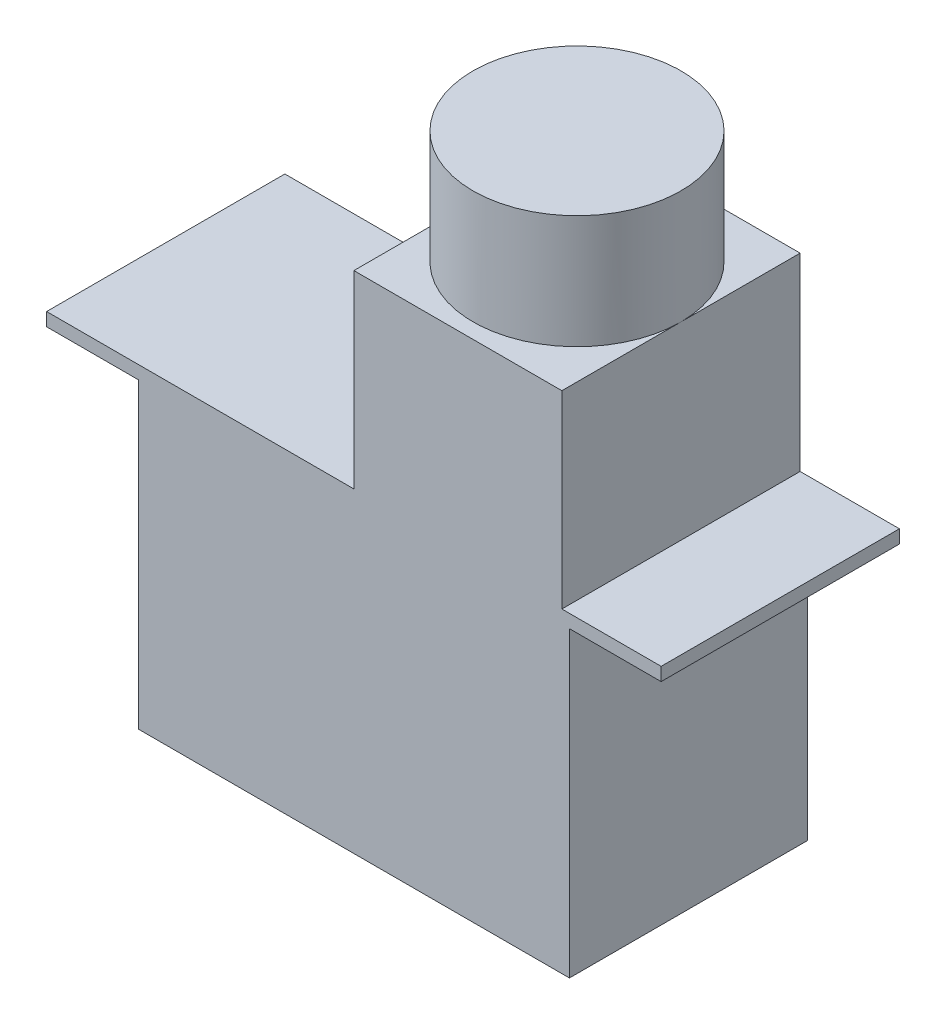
SolidWorks part; units mm, degrees
ref_plane "Front Plane" through (0, 0, 0) normal (0, 0, 1) x (1, 0, 0)
ref_plane "Top Plane" through (0, 0, 0) normal (0, 1, 0) x (1, 0, 0)
ref_plane "Right Plane" through (0, 0, 0) normal (1, 0, 0) x (0, 0, -1)
sketch "Sketch1" plane through (0, 0, 0) normal (0, 1, 0) x (1, 0, 0)
  line L1 (0, 0) -> (22.8, 0)
  line L2 (0, 0) -> (0, 12.6)
  line L3 (0, 12.6) -> (22.8, 12.6)
  line L4 (22.8, 0) -> (22.8, 12.6)
  dimension "D1" = 22.8
  dimension "D2" = 12.6
extrude "Boss-Extrude1" add sketch "Sketch1" along normal blind 16
sketch "Sketch2" plane through (0, 16, 0) normal (0, 1, 0) x (1, 0, 0)
  line L0 (11.4, 12.6) -> (11.4, 0) construction
  line L1 (27.65, 6.3) -> (-4.85, 6.3) construction
  line L2 (22.8, 12.6) -> (0, 12.6) construction
  line L3 (-4.85, 6.3) -> (-4.85, 12.6)
  line L4 (0, 0) -> (22.8, 0) construction
  line L5 (-4.85, 12.6) -> (27.65, 12.6)
  line L6 (27.65, 12.6) -> (27.65, 0)
  line L7 (27.65, 0) -> (-4.85, 0)
  line L8 (-4.85, 0) -> (-4.85, 6.3)
  point P9 (11.4, 6.3)
  dimension "D1" = 32.5
  dimension "D2" = 90
extrude "Boss-Extrude2" add sketch "Sketch2" along normal blind 0.7
sketch "Sketch3" plane through (0, 16.7, 0) normal (0, 1, 0) x (1, 0, 0)
  line L0 (11.4, 0) -> (11.4, 12.6)
  line L1 (-4.85, 0) -> (27.65, 0) construction
  line L2 (27.65, 12.6) -> (-4.85, 12.6) construction
  line L3 (11.4, 12.6) -> (22.4, 12.6)
  line L6 (22.4, 12.6) -> (22.4, 0)
  line L7 (22.4, 0) -> (11.4, 0)
  dimension "D1" = 11
extrude "Boss-Extrude3" add sketch "Sketch3" along normal blind 10
sketch "Sketch4" plane through (0, 26.7, 0) normal (0, 1, 0) x (1, 0, 0)
  line L0 (11.4, 12.6) -> (22.4, 0) construction
  circle A0 centre (16.9, 6.3) radius 5.5
  dimension "D1" = 11
extrude "Boss-Extrude4" add sketch "Sketch4" along normal blind 6
